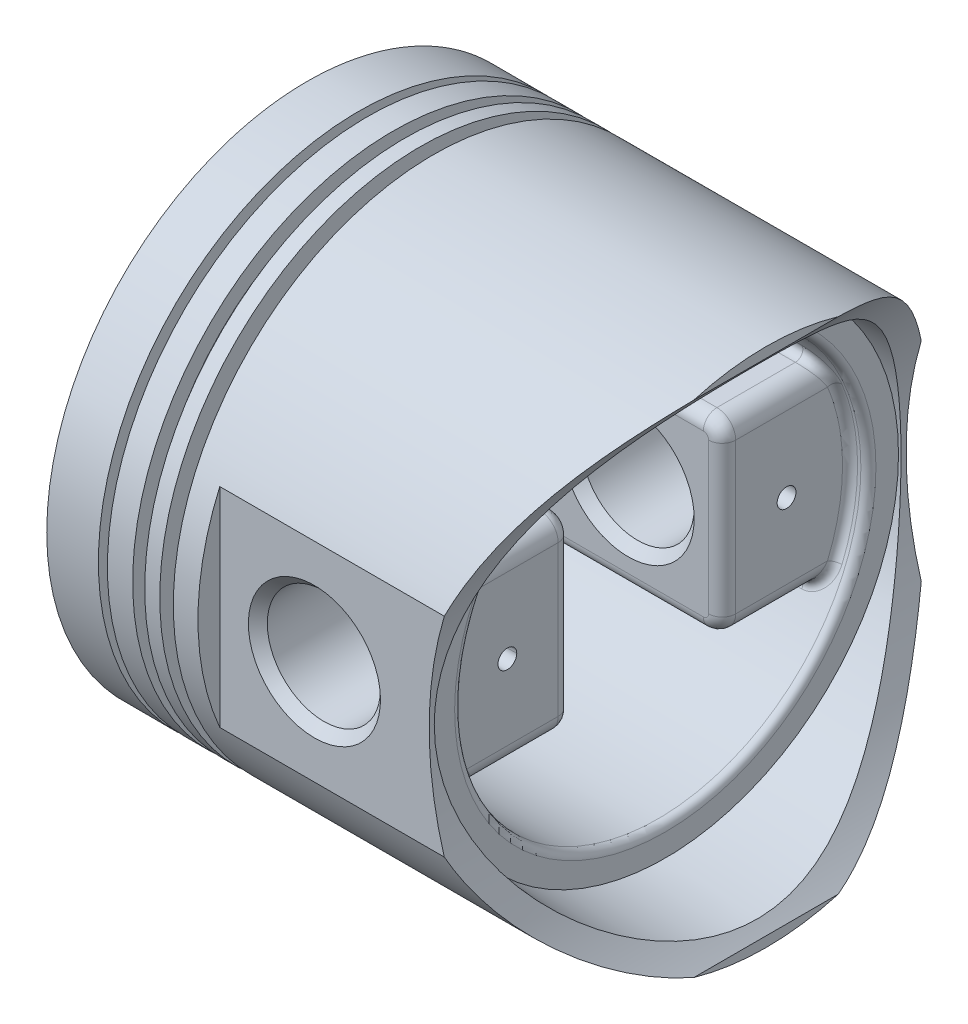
SolidWorks part; units mm, degrees
ref_plane "XY" through (0, 0, 0) normal (0, 0, 1) x (1, 0, 0)
ref_plane "YZ" through (0, 0, 0) normal (0, 1, 0) x (1, 0, 0)
ref_plane "XZ" through (0, 0, 0) normal (1, 0, 0) x (0, 0, -1)
imported_body "Imported1"
sketch "Sketch1" plane through (0, 0, 81.9868) normal (0, 0, 1) x (1, 0, 0)
  line L0 (-204.7649, 0.2223) -> (-125.2629, 0.2223)
  line L1 (-125.2629, 0.2223) -> (-125.2629, 44.1643)
  line L2 (-125.2629, 44.1643) -> (-204.7649, 44.1643)
  line L3 (-204.7649, 44.1643) -> (-204.7649, 0.2223)
extrude "Cut-Extrude1" cut sketch "Sketch1" against normal up to next
mirror "Mirror1"
ref_plane "Plane1" through (0, 0, 81.9868) normal (0, 0, 1) x (1, 0, 0)
